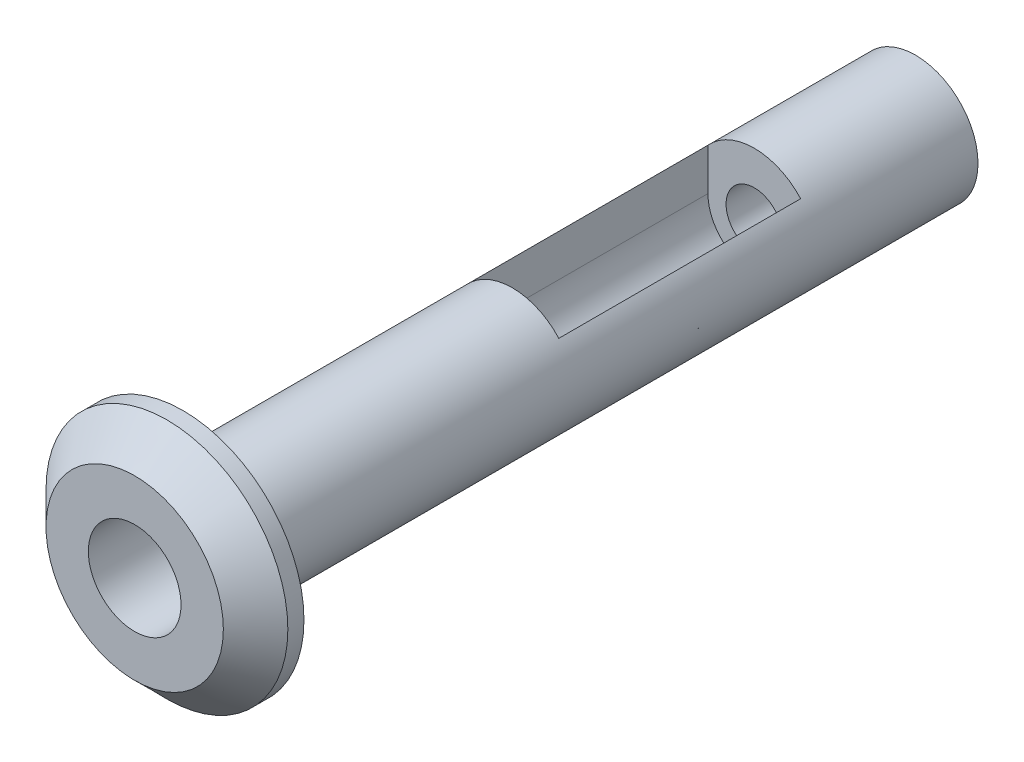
SolidWorks part; units mm, degrees
ref_plane "Alzado" through (0, 0, 0) normal (0, 0, 1) x (1, 0, 0)
ref_plane "Planta" through (0, 0, 0) normal (0, 1, 0) x (1, 0, 0)
ref_plane "Vista lateral" through (0, 0, 0) normal (1, 0, 0) x (0, 0, -1)
sketch "Croquis1" plane through (0, 0, 0) normal (0, 0, 1) x (1, 0, 0)
  circle A0 centre (0, 0) radius 7.5
  circle A1 centre (0, 0) radius 1.75
  dimension "D1" = 15
  dimension "D2" = 3.5
extrude "Saliente-Extruir1" add sketch "Croquis1" along normal mid plane 3
chamfer "Chaflán1" distance 2 angle 45 1 edges at (7.5, 0, 1.5)
sketch "Croquis2" plane through (0, 0, -1.5) normal (0, 0, -1) x (-1, 0, 0)
  circle A2 centre (0, 0) radius 1.75 construction
  circle A3 centre (0, 0) radius 1.75
  circle A4 centre (0, 0) radius 3.875
  dimension "D1" = 7.75
extrude "Saliente-Extruir2" add sketch "Croquis2" along normal blind 45.43
sketch "Croquis3" plane through (0, 0, 1.5) normal (0, 0, 1) x (1, 0, 0)
  circle A0 centre (0, 0) radius 2.875
  dimension "D1" = 5.75
extrude "Cortar-Extruir1" cut sketch "Croquis3" against normal offset from surface (38.43 mm away) 10
sketch "Croquis4" plane through (0, 0, -36.93) normal (0, 0, 1) x (1, 0, 0)
  line L0 (0, 0) -> (-2.875, 0)
  line L1 (-2.875, 0) -> (-2.875, 2.5981)
  line L2 (0, 0) -> (2.875, 0)
  line L3 (2.875, 0) -> (2.875, 2.5981)
  circle A0 centre (0, 0) radius 3.875 construction
  arc A1 (2.875, 2.5981) -> (-2.875, 2.5981) centre (0, 0) ccw
  circle A2 centre (0, 0) radius 2.875 construction
  arc A3 (-2.875, 2.5981) -> (2.875, 2.5981) centre (0, 0) ccw construction
extrude "Cortar-Extruir2" cut sketch "Croquis4" along normal blind 15
